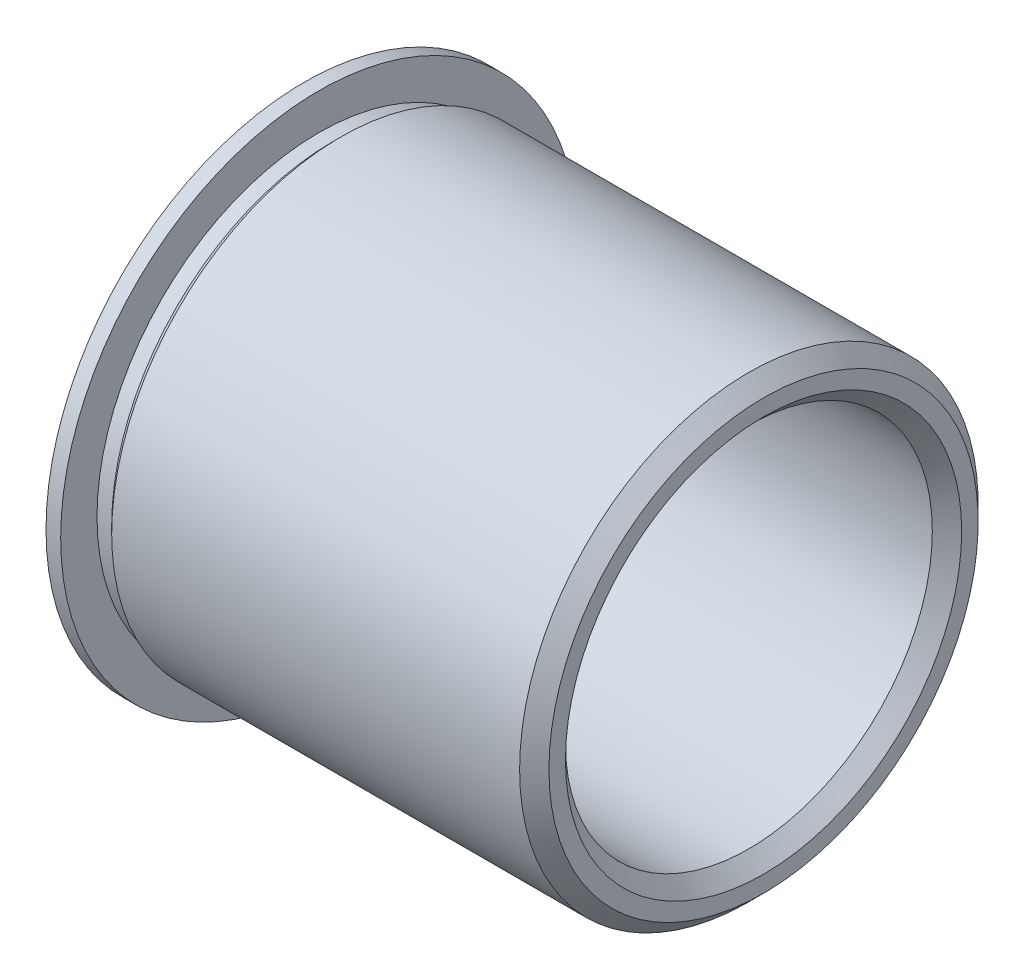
SolidWorks part; units mm, degrees
ref_plane "Front Plane" through (0, 0, 0) normal (0, 0, 1) x (1, 0, 0)
ref_plane "Top Plane" through (0, 0, 0) normal (0, 1, 0) x (1, 0, 0)
ref_plane "Right Plane" through (0, 0, 0) normal (1, 0, 0) x (0, 0, -1)
sketch "Sketch2" plane through (0, 0, 0) normal (0, 0, 1) x (1, 0, 0)
  line L0 (-53.0413, 94.6527) -> (-53.0413, 99.1231)
  line L1 (-53.0413, 99.1231) -> (-52.7873, 99.1231)
  line L2 (-53.0413, 94.6527) -> (-45.0911, 94.6527)
  line L3 (-45.0911, 94.6527) -> (-45.0911, 98.3674)
  line L4 (-45.0911, 98.3674) -> (-45.3451, 98.6214)
  line L5 (-45.3451, 98.6214) -> (-52.4063, 98.6214)
  line L6 (-52.4063, 98.6214) -> (-52.5333, 98.4944)
  line L7 (-52.5333, 98.4944) -> (-52.7873, 98.4944)
  line L8 (-52.7873, 98.4944) -> (-52.7873, 99.1231)
  dimension "D1" = 4.4704
  dimension "D2" = 0.254
  dimension "D3" = 3.9688
  dimension "D4" = 0.254
  dimension "D5" = 0.254
  dimension "D6" = 7.9502
  dimension "D7" = 0.127
  dimension "D8" = 0.254
revolve "Revolve3" add sketch "Sketch2" angle 360 about L2
sketch "Sketch3" plane through (-45.0911, 0, 0) normal (1, 0, 0) x (0, 0, -1)
  circle A0 centre (0, 94.6527) radius 3.175
  dimension "D1" = 6.35
extrude "Cut-Extrude1" cut sketch "Sketch3" against normal through all
chamfer "Chamfer2" distance 0.254 angle 45 1 edges at (-53.0413, 94.6527, -3.175)
chamfer "Chamfer3" distance 0.254 angle 45 1 edges at (-45.0911, 94.6527, -3.175)
